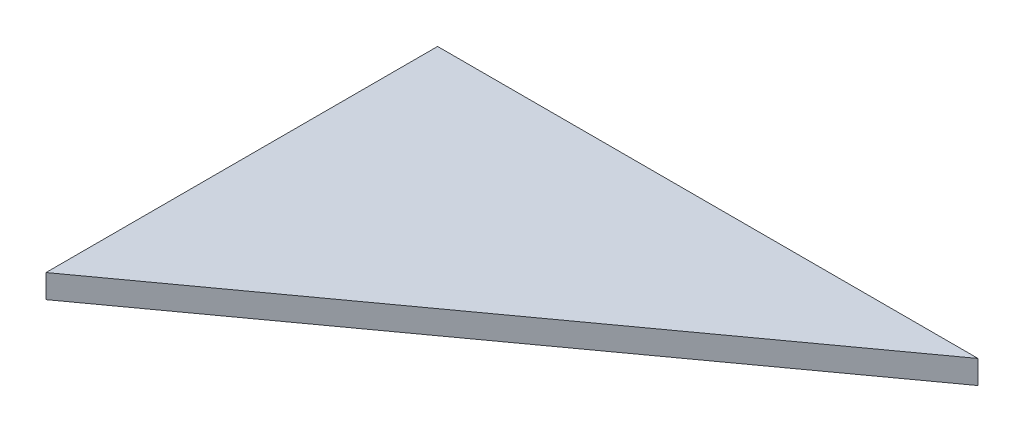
SolidWorks part; units mm, degrees
ref_plane "Plan de face" through (0, 0, 0) normal (0, 0, 1) x (1, 0, 0)
ref_plane "Plan de dessus" through (0, 0, 0) normal (0, 1, 0) x (1, 0, 0)
ref_plane "Plan de droite" through (0, 0, 0) normal (1, 0, 0) x (0, 0, -1)
sketch "Esquisse1" plane through (0, 0, 0) normal (0, 1, 0) x (1, 0, 0)
  line L0 (0, 0) -> (0, -50)
  line L1 (0, -50) -> (69, 0)
  line L2 (69, 0) -> (0, 0)
  dimension "D1" = 69
  dimension "D2" = 50
extrude "Extrusion1" add sketch "Esquisse1" along normal blind 3
